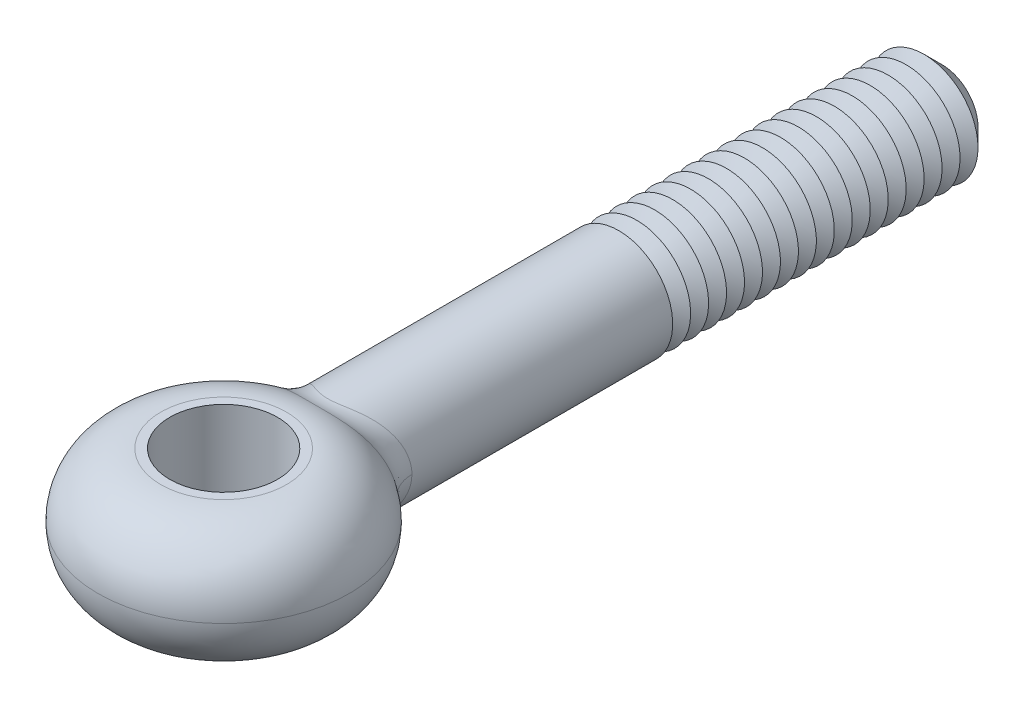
SolidWorks part; units mm, degrees
ref_plane "Front Plane" through (0, 0, 0) normal (0, 0, 1) x (1, 0, 0)
ref_plane "Top Plane" through (0, 0, 0) normal (0, 1, 0) x (1, 0, 0)
ref_plane "Right Plane" through (0, 0, 0) normal (1, 0, 0) x (0, 0, -1)
sketch "Sketch7" plane through (0, 0, 0) normal (0, 1, 0) x (1, 0, 0)
  circle A0 centre (0, 0) radius 7
  dimension "D1" = 14
extrude "Boss-Extrude3" add sketch "Sketch7" along normal mid plane 7
sketch "Sketch8" plane through (0, 0, 0) normal (0, 0, 1) x (1, 0, 0)
  circle A0 centre (0, 0) radius 3
  dimension "D1" = 6
extrude "Boss-Extrude4" add sketch "Sketch8" against normal blind 40
fillet "Fillet5" radius 3.5 2 edges at (0, -3.5, 7) (0, 3.5, 7)
fillet "Fillet6" radius 2 2 edges at (0.1487, -2.9963, -5.3068) (-0.1487, 2.9963, -5.3068)
chamfer "Chamfer1" distance 1 angle 45 1 edges at (3, 0, -40)
sketch "Sketch10" plane through (0, 0, 0) normal (0, 1, 0) x (1, 0, 0)
  line L0 (0, 28.1405) -> (0, -7.9233) construction
sketch "Sketch11" plane through (0, 0, 0) normal (0, 1, 0) x (1, 0, 0)
  line L0 (-3, 22) -> (-2.134, 22.5)
  line L1 (-3, 39) -> (-3, 7.4833) construction
  line L2 (-2.134, 22.5) -> (-3, 23)
  line L3 (-3, 23) -> (-3, 22)
  line L4 (2, 40) -> (-2, 40) construction
  dimension "D1" = 1
  dimension "D2" = 18
revolve "Cut-Revolve1" cut sketch "Sketch11" angle 360 about L0
pattern_linear "LPattern1" count 17 spacing 1 along (0, 0, -1) of "Cut-Revolve1"
sketch "Sketch12" plane through (0, 0, 0) normal (0, 1, 0) x (1, 0, 0)
  circle A0 centre (0, 0) radius 3
  dimension "D1" = 6
extrude "Cut-Extrude1" cut sketch "Sketch12" against normal mid plane 7
